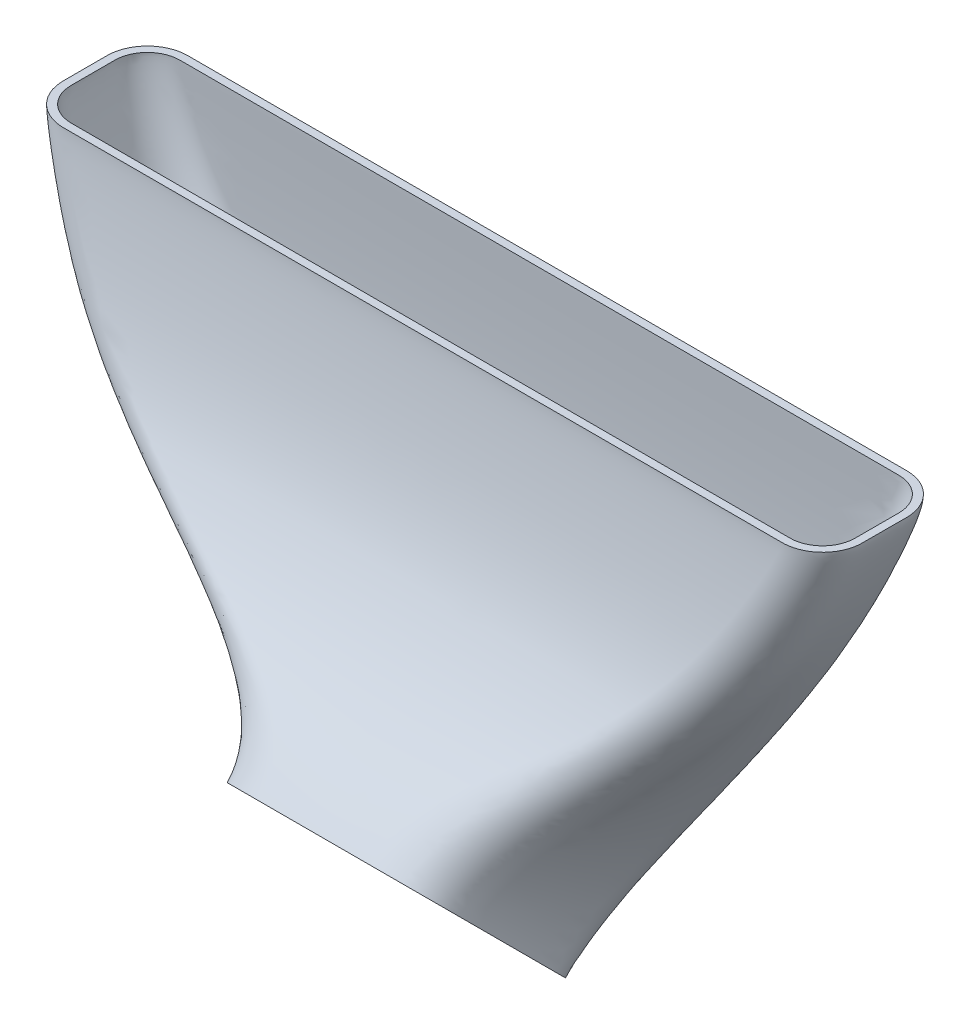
SolidWorks part; units mm, degrees
ref_plane "Front Plane" through (0, 0, 0) normal (0, 0, 1) x (1, 0, 0)
ref_plane "Top Plane" through (0, 0, 0) normal (0, 1, 0) x (1, 0, 0)
ref_plane "Right Plane" through (0, 0, 0) normal (1, 0, 0) x (0, 0, -1)
sketch "Sketch1" plane through (0, 0, 0) normal (1, 0, 0) x (0, 0, -1)
  line L0 (0, 0) -> (0, -69.85)
  line L1 (0, -69.85) -> (-44.9013, -114.7513)
  dimension "D1" = 69.85
  dimension "D2" = 63.5
  dimension "D3" = 135
sketch "Sketch2" plane through (0, 0, 0) normal (0, 1, 0) x (1, 0, 0)
  line L0 (-114.3, -15.875) -> (114.3, 15.875) construction
  line L1 (-104.775, 15.875) -> (104.775, 15.875)
  line L2 (-114.3, 6.35) -> (-114.3, -6.35)
  line L3 (-104.775, -15.875) -> (104.775, -15.875)
  line L4 (114.3, 6.35) -> (114.3, -6.35)
  arc A0 (-104.775, 15.875) -> (-114.3, 6.35) centre (-104.775, 6.35) ccw
  arc A1 (104.775, 15.875) -> (114.3, 6.35) centre (104.775, 6.35) cw
  arc A2 (104.775, -15.875) -> (114.3, -6.35) centre (104.775, -6.35) ccw
  arc A3 (-104.775, -15.875) -> (-114.3, -6.35) centre (-104.775, -6.35) cw
  point P6 (-114.3, 15.875)
  point P12 (114.3, -15.875)
  dimension "D3" = 9.525
  dimension "D1" = 228.6
  dimension "D2" = 31.75
ref_plane "Plane1" through (0, -31.75, 0) normal (0, 1, 0) x (1, 0, 0)
ref_plane "Plane2" through (0, -114.7513, 44.9013) normal (0, -0.7071, 0.7071) x (1, 0, 0)
sketch "Sketch3" plane through (0, -31.75, 0) normal (0, 1, 0) x (1, 0, 0)
  line L1 (88.9, -22.225) -> (-88.9, -22.225)
  line L2 (101.6, -9.525) -> (101.6, 3.175)
  line L3 (88.9, 15.875) -> (-88.9, 15.875)
  line L4 (-101.6, -9.525) -> (-101.6, 3.175)
  line L5 (0, -22.225) -> (0, 15.875) construction
  line L6 (-104.775, 15.875) -> (104.775, 15.875) construction
  arc A0 (88.9, -22.225) -> (101.6, -9.525) centre (88.9, -9.525) ccw
  arc A1 (-88.9, -22.225) -> (-101.6, -9.525) centre (-88.9, -9.525) cw
  arc A2 (-88.9, 15.875) -> (-101.6, 3.175) centre (-88.9, 3.175) ccw
  arc A3 (101.6, 3.175) -> (88.9, 15.875) centre (88.9, 3.175) ccw
  point P10 (101.6, -22.225)
  point P15 (-101.6, 15.875)
  point P18 (101.6, 15.875)
  dimension "D3" = 12.7
  dimension "D1" = 38.1
  dimension "D2" = 203.2
sketch "Sketch4" plane through (0, -114.7513, 44.9013) normal (0, -0.7071, 0.7071) x (1, 0, 0)
  line L1 (3.175, -31.75) -> (34.925, -31.75)
  line L2 (-12.7, -15.875) -> (-12.7, 15.875)
  line L3 (3.175, 31.75) -> (34.925, 31.75)
  line L4 (50.8, -15.875) -> (50.8, 15.875)
  line L5 (0, 3.6166) -> (0, 95.1662) construction
  circle A0 centre (19.05, 0) radius 31.75 construction
  arc A1 (3.175, -31.75) -> (-12.7, -15.875) centre (3.175, -15.875) cw
  arc A2 (-12.7, 15.875) -> (3.175, 31.75) centre (3.175, 15.875) cw
  arc A3 (34.925, 31.75) -> (50.8, 15.875) centre (34.925, 15.875) cw
  arc A4 (34.925, -31.75) -> (50.8, -15.875) centre (34.925, -15.875) ccw
  dimension "D1" = 63.5
  dimension "D2" = 19.05
  dimension "D3" = 15.875
other "Boundary1" parameters "D1"=2.286
